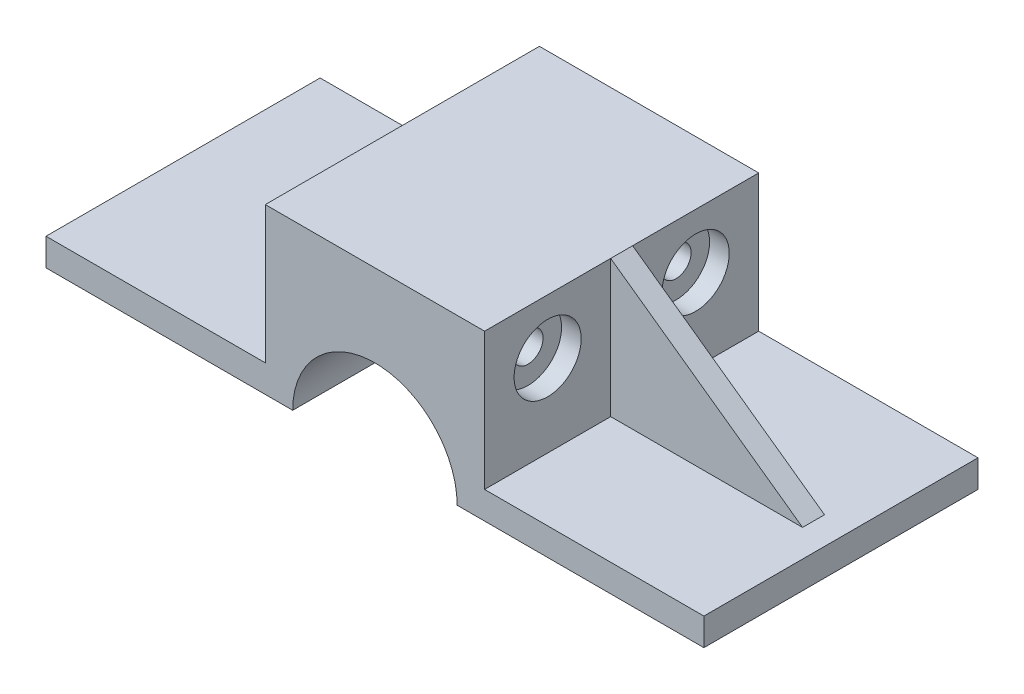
SolidWorks part; units mm, degrees
ref_plane "Front Plane" through (0, 0, 0) normal (0, 0, 1) x (1, 0, 0)
ref_plane "Top Plane" through (0, 0, 0) normal (0, 1, 0) x (1, 0, 0)
ref_plane "Right Plane" through (0, 0, 0) normal (1, 0, 0) x (0, 0, -1)
sketch "Sketch1" plane through (0, 0, 0) normal (0, 0, 1) x (1, 0, 0)
  line L0 (-60, 0) -> (-15, 0)
  line L1 (-60, 0) -> (-60, 5)
  line L2 (-60, 5) -> (-20, 5)
  line L3 (-20, 5) -> (-20, 30)
  line L4 (-20, 30) -> (20, 30)
  line L5 (0, 30) -> (0, 15) construction
  line L6 (20, 5) -> (20, 30)
  line L7 (60, 5) -> (20, 5)
  line L8 (60, 0) -> (60, 5)
  line L9 (60, 0) -> (15, 0)
  arc A0 (-15, 0) -> (15, 0) centre (0, 0) cw
  dimension "D5" = 15
  dimension "D1" = 5
  dimension "D2" = 20
  dimension "D3" = 30
  dimension "D4" = 60
extrude "Extrude1" add sketch "Sketch1" along normal mid plane 50
sketch "Sketch4" plane through (0, 0, 0) normal (0, 0, 1) x (1, 0, 0)
  line L0 (20, 30) -> (55, 5)
  line L2 (60, 5) -> (20, 5) construction
  line L3 (20, 5) -> (20, 30) construction
  dimension "D1" = 35
rib "Rib" sketch "Sketch4" sketch "Sketch4" thickness 4 extrusion direction parallel to sketch draft on no parameters "D1"=4
hole_wizard "CBORE for M5 Hex Head Bolt3" positions "Sketch9" profile "Sketch10" counterbore size "M5" standard "Ansi Metric"
sketch "Sketch9" plane through (20, 0, 0) normal (1, 0, 0) x (0, 0, -1)
  line L0 (-25, 20) -> (-2, 20) construction
  line L1 (-25, 5) -> (-25, 30) construction
  line L2 (-2, 5) -> (-2, 30) construction
  line L3 (-25, 30) -> (-2, 30) construction
  line L4 (0, 30) -> (0, 16.0984) construction
  line L5 (-2, 30) -> (2, 30) construction
  point P0 (-13.5, 20)
  point P25 (13.5, 20)
  dimension "D1" = 10
sketch "Sketch10" plane through (20, 20, 13.5) normal (0, 1, 0) x (0, 0, -1)
  line L0 (0, 0) -> (0, 11.6524)
  line L1 (0, 11.6524) -> (2.75, 10)
  line L2 (2.75, 10) -> (2.75, 3.58)
  line L3 (2.75, 3.58) -> (6.12, 3.58)
  line L4 (6.12, 3.58) -> (6.12, 0)
  line L5 (6.12, 0) -> (0, 0)
  line L10 (0, 11.6524) -> (-2.75, 10) construction
  line L11 (0, -6.35) -> (0, 107.95) construction
  dimension "Hole Dia." = 5.5
  dimension "Hole Depth" = 10
  dimension "C'Bore Dia." = 12.24
  dimension "C'Bore Depth" = 3.58
  dimension "Drill Angle" = 118
